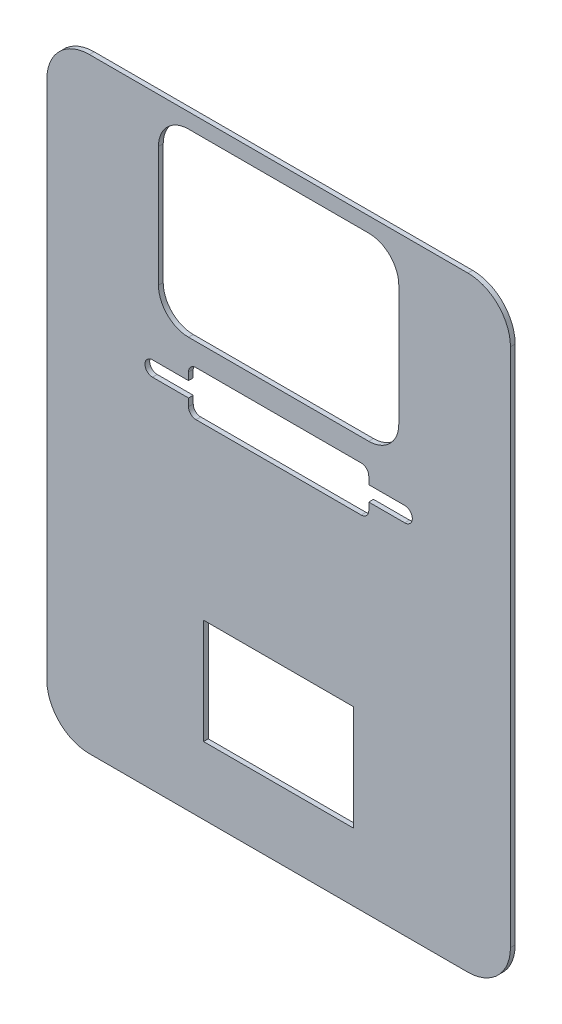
SolidWorks part; units mm, degrees
ref_plane "Front Plane" through (0, 0, 0) normal (0, 0, 1) x (1, 0, 0)
ref_plane "Top Plane" through (0, 0, 0) normal (0, 1, 0) x (1, 0, 0)
ref_plane "Right Plane" through (0, 0, 0) normal (1, 0, 0) x (0, 0, -1)
sketch "Sketch1" plane through (0, 0, 0) normal (0, 0, 1) x (1, 0, 0)
  line L0 (64, 73.8) -> (24, 73.8) construction
  line L1 (19, 68.8) -> (19, 13.8) construction
  line L2 (24, 8.8) -> (64, 8.8) construction
  line L3 (69, 13.8) -> (69, 68.8) construction
  line L4 (69, 13.8) -> (69, 68.8) construction
  line L5 (24, 8.8) -> (64, 8.8) construction
  line L6 (19, 68.8) -> (19, 13.8) construction
  line L7 (64, 73.8) -> (24, 73.8) construction
  line L8 (68.5, 13.8) -> (68.5, 68.8)
  line L9 (64, 73.3) -> (24, 73.3)
  line L10 (19.5, 68.8) -> (19.5, 13.8)
  line L11 (24, 9.3) -> (64, 9.3)
  arc A0 (64, 8.8) -> (69, 13.8) centre (64, 13.8) ccw construction
  arc A1 (24, 73.8) -> (19, 68.8) centre (24, 68.8) ccw construction
  arc A2 (19, 13.8) -> (24, 8.8) centre (24, 13.8) ccw construction
  arc A3 (69, 68.8) -> (64, 73.8) centre (64, 68.8) ccw construction
  arc A4 (69, 68.8) -> (64, 73.8) centre (64, 68.8) ccw construction
  arc A5 (64, 8.8) -> (69, 13.8) centre (64, 13.8) ccw construction
  arc A6 (19, 13.8) -> (24, 8.8) centre (24, 13.8) ccw construction
  arc A7 (24, 73.8) -> (19, 68.8) centre (24, 68.8) ccw construction
  arc A8 (68.5, 68.8) -> (64, 73.3) centre (64, 68.8) ccw
  arc A9 (24, 73.3) -> (19.5, 68.8) centre (24, 68.8) ccw
  arc A10 (19.5, 13.8) -> (24, 9.3) centre (24, 13.8) ccw
  arc A11 (64, 9.3) -> (68.5, 13.8) centre (64, 13.8) ccw
  dimension "D1" = 0.5
extrude "Boss-Extrude2" add sketch "Sketch1" against normal up to surface (0.5 mm away)
sketch "Sketch2" plane through (0, 0, 0) normal (0, 0, 1) x (1, 0, 0)
  line L0 (44, 73.3) -> (44, 9.3) construction
  line L1 (34.475, 52.6619) -> (53.525, 52.6619)
  line L2 (31.3, 55.8369) -> (31.3, 68.5369)
  line L3 (34.475, 71.7119) -> (53.525, 71.7119)
  line L4 (56.7, 55.8369) -> (56.7, 68.5369)
  line L5 (31.3, 52.6619) -> (56.7, 71.7119) construction
  line L6 (31.3, 71.7119) -> (56.7, 52.6619) construction
  line L7 (64, 73.3) -> (24, 73.3) construction
  line L8 (24, 9.3) -> (64, 9.3) construction
  line L9 (34.475, 47.893) -> (53.525, 47.893) construction
  line L10 (35.2688, 45.5118) -> (52.7313, 45.5118)
  line L11 (34.475, 46.3055) -> (34.475, 47.0993)
  line L12 (35.2688, 50.2743) -> (52.7312, 50.2743)
  line L13 (53.525, 46.3055) -> (53.525, 47.0993)
  line L14 (34.475, 45.5118) -> (53.525, 50.2743) construction
  line L15 (34.475, 50.2743) -> (53.525, 45.5118) construction
  line L16 (52.7313, 47.893) -> (57.3357, 47.893) construction
  line L17 (53.525, 48.6868) -> (57.3357, 48.6868)
  line L18 (53.525, 47.0993) -> (57.3357, 47.0993)
  line L19 (53.525, 48.6868) -> (53.525, 49.4805)
  line L20 (34.475, 47.0993) -> (30.6643, 47.0993)
  line L21 (34.475, 48.6868) -> (30.6643, 48.6868)
  line L22 (34.475, 48.6868) -> (34.475, 49.4805)
  line L24 (36.0625, 16.4437) -> (51.9375, 16.4437)
  line L25 (36.0625, 16.4437) -> (36.0625, 27.5562)
  line L26 (36.0625, 27.5562) -> (51.9375, 27.5562)
  line L27 (51.9375, 16.4437) -> (51.9375, 27.5562)
  line L28 (36.0625, 16.4437) -> (51.9375, 27.5562) construction
  line L29 (36.0625, 27.5562) -> (51.9375, 16.4437) construction
  arc A0 (34.475, 52.6619) -> (31.3, 55.8369) centre (34.475, 55.8369) cw
  arc A1 (31.3, 68.5369) -> (34.475, 71.7119) centre (34.475, 68.5369) cw
  arc A2 (53.525, 71.7119) -> (56.7, 68.5369) centre (53.525, 68.5369) cw
  arc A3 (53.525, 52.6619) -> (56.7, 55.8369) centre (53.525, 55.8369) ccw
  arc A4 (30.6643, 47.0993) -> (30.6643, 48.6868) centre (30.6643, 47.893) cw
  arc A5 (57.3357, 47.0993) -> (57.3357, 48.6868) centre (57.3357, 47.893) ccw
  arc A6 (52.7313, 45.5118) -> (53.525, 46.3055) centre (52.7313, 46.3055) ccw
  arc A7 (35.2688, 45.5118) -> (34.475, 46.3055) centre (35.2688, 46.3055) cw
  arc A8 (34.475, 49.4805) -> (35.2688, 50.2743) centre (35.2688, 49.4805) cw
  arc A9 (52.7312, 50.2743) -> (53.525, 49.4805) centre (52.7312, 49.4805) cw
  point P0 (44, 62.1869)
  point P11 (44, 47.893)
  point P32 (54.3188, 47.893)
  point P38 (44, 22)
  dimension "D1" = 3.175
  dimension "D12" = 0.7938
  dimension "D13" = 0.7937
  dimension "D2" = 1.5881
  dimension "D3" = 19.05
  dimension "D4" = 25.4
  dimension "D5" = 2.3876
  dimension "D6" = 19.05
  dimension "D7" = 4.7625
  dimension "D8" = 0.7938
  dimension "D9" = 0.7937
  dimension "D10" = 2.3813
  dimension "D11" = 1.5875
  dimension "D14" = 11.1125
  dimension "D15" = 12.7
  dimension "D16" = 15.875
extrude "Cut-Extrude1" cut sketch "Sketch2" against normal up to next
